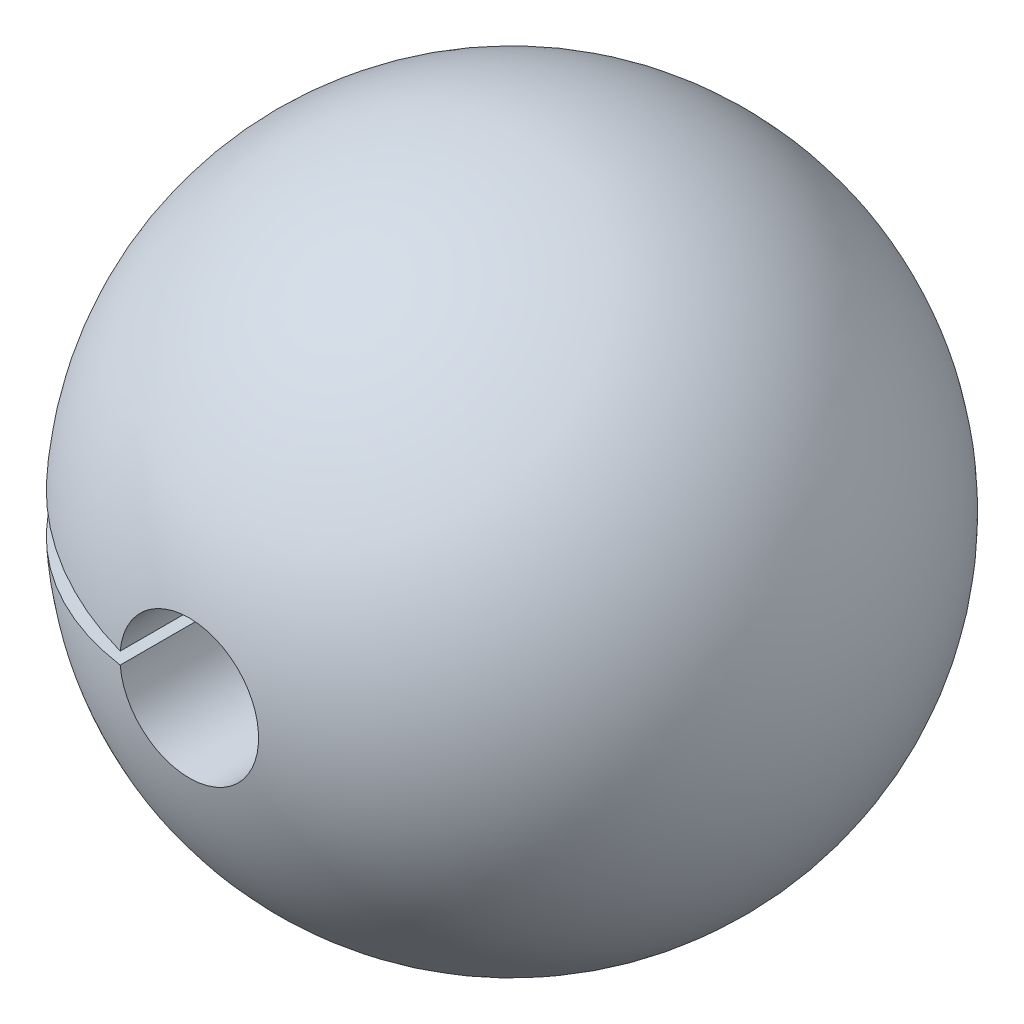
SolidWorks part; units mm, degrees
ref_plane "前视基准面" through (0, 0, 0) normal (0, 0, 1) x (1, 0, 0)
ref_plane "上视基准面" through (0, 0, 0) normal (0, 1, 0) x (1, 0, 0)
ref_plane "右视基准面" through (0, 0, 0) normal (1, 0, 0) x (0, 0, -1)
sketch "草图1" plane through (0, 0, 0) normal (0, 1, 0) x (1, 0, 0)
  line L0 (0, 1431) -> (0, -1431)
  arc A0 (0, -1431) -> (0, 1431) centre (0, 0) ccw
  dimension "D1" = 2862
revolve "旋转1" add sketch "草图1" angle 360 about L0
sketch "草图2" plane through (0, 0, 0) normal (0, 0, 1) x (1, 0, 0)
  circle A0 centre (0, 0) radius 301
  dimension "D1" = 602
extrude "切除-拉伸1" cut sketch "草图2" against normal mid plane 50000
sketch "草图3" plane through (0, 0, 0) normal (0, 0, 1) x (1, 0, 0)
  line L0 (0, 0) -> (-1601.1962, -140.0865)
  line L1 (0, 0) -> (-1601.1962, 140.0865)
  line L2 (-1601.1962, 140.0865) -> (-1601.1962, -140.0865)
  line L3 (1538.8839, 0) -> (-1538.8839, 0) construction
  dimension "D1" = 5
  dimension "D2" = 10
extrude "切除-拉伸2" cut sketch "草图3" against normal mid plane 50000
